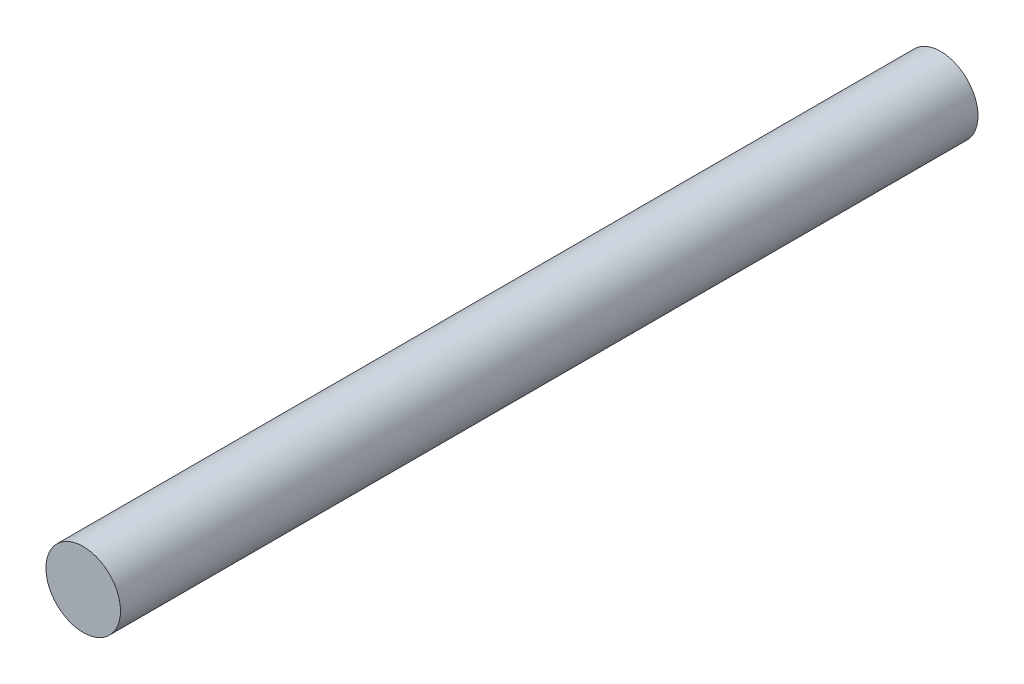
SolidWorks part; units mm, degrees
ref_plane "Front" through (0, 0, 0) normal (0, 0, 1) x (1, 0, 0)
ref_plane "Top" through (0, 0, 0) normal (0, 1, 0) x (1, 0, 0)
ref_plane "Right" through (0, 0, 0) normal (1, 0, 0) x (0, 0, -1)
sketch "Sketch2" plane through (0, 0, 0) normal (0, 0, 1) x (1, 0, 0)
  circle A0 centre (0, 0) radius 50.8
extrude "Base-Extrude" add sketch "Sketch2" against normal blind 1168.4
